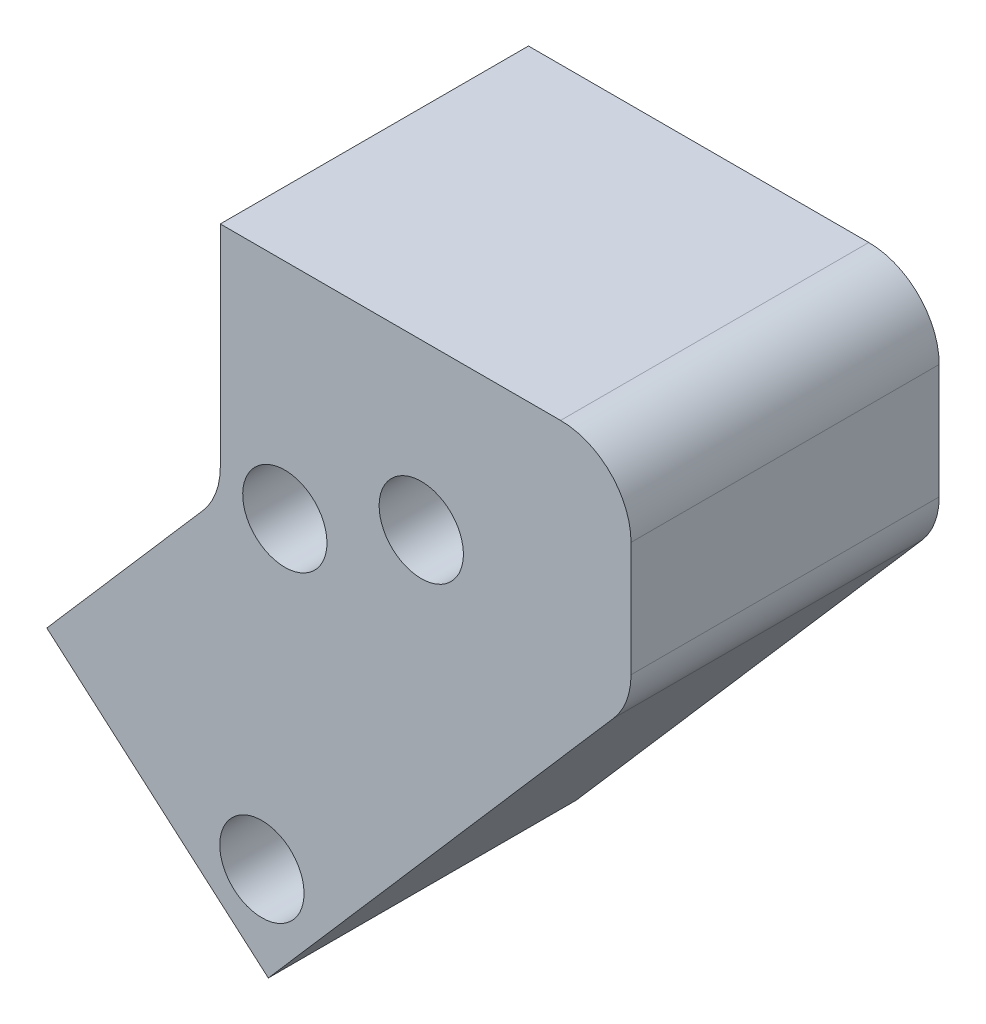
SolidWorks part; units mm, degrees
ref_plane "Front" through (0, 0, 0) normal (0, 0, 1) x (1, 0, 0)
ref_plane "Top" through (0, 0, 0) normal (0, 1, 0) x (1, 0, 0)
ref_plane "Right" through (0, 0, 0) normal (1, 0, 0) x (0, 0, -1)
ref_plane "Plane1" through (0, 0, -31.75) normal (0, 0, 1) x (1, 0, 0)
sketch "Sketch1" plane through (0, 0, -31.75) normal (0, 0, 1) x (1, 0, 0)
  line L0 (-619.125, -20.8199) -> (-619.125, -33.2277)
  line L1 (-658.3775, -81.2739) -> (-620.9917, -38.224)
  line L2 (-658.3775, -81.2739) -> (-682.3497, -60.4558)
  line L4 (-682.3497, -60.4558) -> (-665.4417, -40.9862)
  line L5 (-635.0419, -54.4029) -> (-676.6782, -102.3473) construction
  line L6 (-668.6902, -72.3181) -> (-674.0757, -67.6412) construction
  line L7 (-668.6902, -72.3181) -> (-674.0757, -67.6412) construction
  line L8 (-651.4442, -13.1999) -> (-637.6631, -13.1999) construction
  line L9 (-651.4442, -13.1999) -> (-637.6631, -13.1999) construction
  line L10 (-618.363, -85.471) -> (-618.363, 85.471) construction
  line L11 (-663.575, -13.1999) -> (-626.745, -13.1999)
  line L12 (-663.575, -35.9898) -> (-663.575, -13.1999)
  arc A4 (-663.575, -35.9898) -> (-665.4417, -40.9862) centre (-671.195, -35.9898) cw
  arc A5 (-619.125, -33.2277) -> (-620.9917, -38.224) centre (-626.745, -33.2277) cw
  arc A6 (-619.125, -20.8199) -> (-626.745, -13.1999) centre (-626.745, -20.8199) ccw
  point P25 (-658.3775, -81.2739)
  dimension "D5" = 0.762
  dimension "D6" = 7.62
  dimension "D7" = 7.62
  dimension "D1" = 0
  dimension "D2" = 44.45
  dimension "D3" = 0
  dimension "D4" = 31.75
extrude "Boss-Extrude1" add sketch "Sketch1" along normal blind 57.7596
surface "Surface-Offset1" parameters "D1"=0
sketch "Sketch2" plane through (-335.0856, 290.9981, 0) normal (0.755, -0.6557, 0) x (0, 0, -1)
  line L0 (-1.5999, -448.8241) -> (-1.5999, -492.7742) construction
  line L2 (-1.5999, -493.0559) -> (-0.508, -493.0559)
  line L3 (0, -493.5639) -> (0, -544.3639)
  line L4 (31.75, -493.0559) -> (31.75, -436.0384) construction
  line L6 (-1.5999, -377.4859) -> (-1.5999, -493.0559)
  arc A0 (-0.508, -493.0559) -> (0, -493.5639) centre (-0.508, -493.5639) cw
  dimension "D1" = 0.508
  dimension "D2" = 31.75
  dimension "D3" = 115.57
  dimension "D4" = 50.8
extrude "Cut-Extrude3" cut sketch "Sketch2" against normal through all both and the other way through all flip side to cut
delete or keep bodies "Body-Delete/Keep 1" type delete bodies bodies 104
hole_wizard "Hole1" positions "Point_Sketch" profile "Profil_Sketch" counterbore size "1/4" standard "ANSI Inch"
sketch "Point_Sketch" plane through (-671.9405, -70.4851, 1.5999) normal (0, 0, -1) x (1, 0, 0)
  point P0 (12.8691, 0.935)
  point P2 (15.3505, -33.1552)
  point P4 (30.1147, -39.4765)
sketch "Profil_Sketch" plane through (-659.0714, -71.4201, 1.5999) normal (1, 0, 0) x (0, -1, 0)
  line L0 (0, 0) -> (0, 33.3499)
  line L1 (0, 33.3499) -> (2.8067, 33.3499)
  line L3 (2.8067, 33.3499) -> (2.8067, 8.636)
  line L4 (2.8067, 8.636) -> (4.5593, 8.636)
  line L5 (4.5593, 8.636) -> (4.5593, 0)
  line L7 (4.5593, 0) -> (0, 0)
  line L11 (0, -6.35) -> (0, 107.95) construction
  dimension "Diameter" = 5.6134
  dimension "Thru Hole Depth" = 33.3499
  dimension "L1" = 8.636
other "usin_LS160_10-24x1.75-SHCS<1>"
